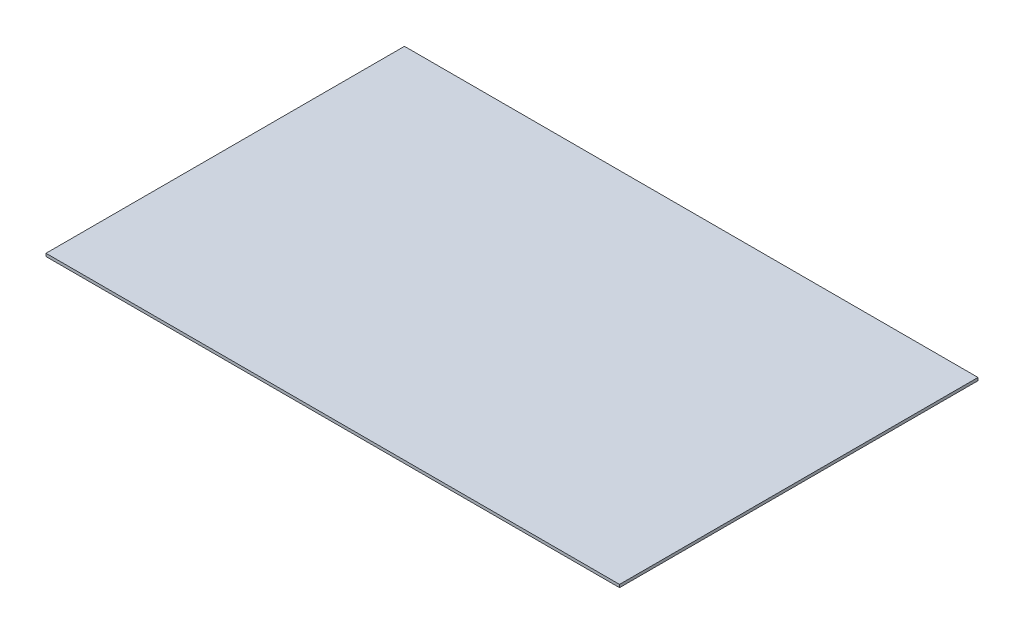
SolidWorks part; units mm, degrees
ref_plane "Front Plane" through (0, 0, 0) normal (0, 0, 1) x (1, 0, 0)
ref_plane "Top Plane" through (0, 0, 0) normal (0, 1, 0) x (1, 0, 0)
ref_plane "Right Plane" through (0, 0, 0) normal (1, 0, 0) x (0, 0, -1)
body saved out of another part "Stock-Sarrus Mechanism-1"
